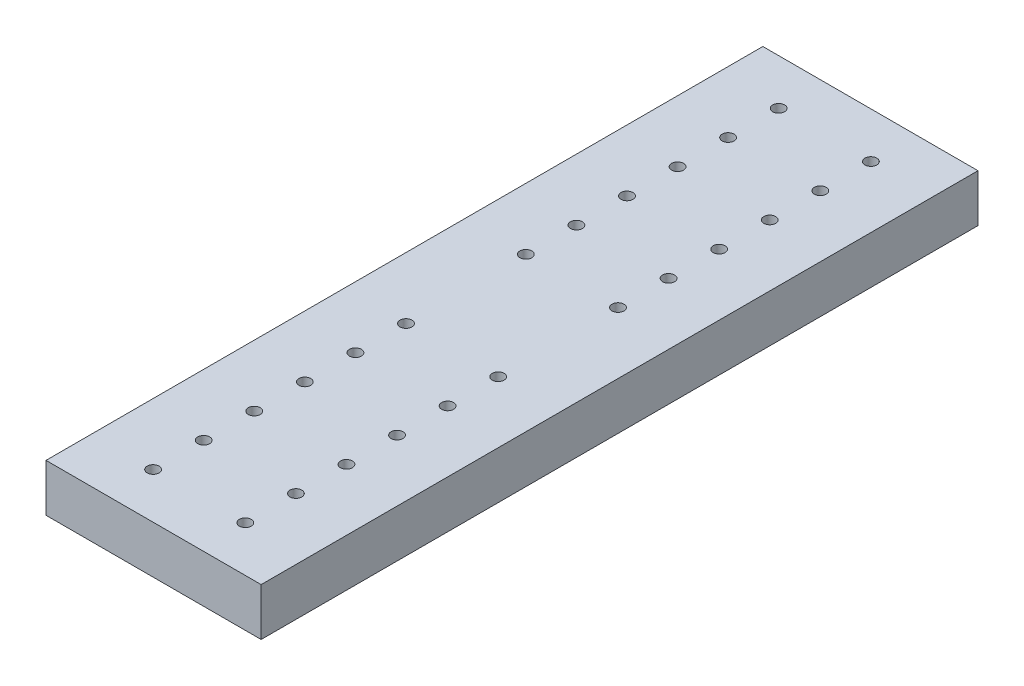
SolidWorks part; units mm, degrees
ref_plane "Front Plane" through (0, 0, 0) normal (1, 0, 0) x (0, 1, 0)
ref_plane "Top Plane" through (0, 0, 0) normal (0, 0, 1) x (0, 1, 0)
ref_plane "Right Plane" through (0, 0, 0) normal (0, 1, 0) x (-1, 0, 0)
sketch "118\"x6\" beam block support" plane through (0, 0, 0) normal (0, 1, 0) x (-1, 0, 0)
  line L1 (-339.725, 1763.525) -> (339.725, 1763.525)
  line L2 (-339.725, 1763.525) -> (-339.725, -1763.525)
  line L3 (-339.725, -1763.525) -> (339.725, -1763.525)
  line L4 (339.725, 1763.525) -> (339.725, -1763.525)
  line L5 (-339.725, 1763.525) -> (339.725, -1763.525) construction
  line L6 (-339.725, -1763.525) -> (339.725, 1763.525) construction
  point P0 (0, 0)
  line B0 (-215.9, 1639.7) -> (215.9, 1639.7) construction
  line B1 (-215.9, 1639.7) -> (-215.9, -1639.7) construction
  line B2 (-215.9, -1639.7) -> (215.9, -1639.7) construction
  line B3 (215.9, 1639.7) -> (215.9, -1639.7) construction
  line B4 (-215.9, 1639.7) -> (215.9, -1639.7) construction
  line B5 (-215.9, -1639.7) -> (215.9, 1639.7) construction
  circle B6 centre (246.0625, 1669.8625) radius 30.1625
  circle B7 centre (-246.0625, 1399.8625) radius 30.1625
  circle B8 centre (246.0625, 1399.8625) radius 30.1625
  circle B9 centre (246.0625, 1129.8625) radius 30.1625
  circle B10 centre (246.0625, 859.8625) radius 30.1625
  circle B11 centre (246.0625, -1129.8625) radius 30.1625
  circle B12 centre (-246.0625, -319.8625) radius 30.1625
  circle B13 centre (246.0625, 319.8625) radius 30.1625
  dimension "D1" = 3527.05
  dimension "D2" = 679.45
sketch_block_instance "bolt hole pat-2"
sketch_block "bolt hole pat" parameters "D1"=60.325, "D2"=60.325, "D3"=60.325, "D4"=60.325
sketch "Sketch1" plane through (0, 0, 0) normal (0, 1, 0) x (-1, 0, 0)
  line L0 (-339.725, 1763.525) -> (339.725, 1763.525) construction
  line L1 (-574.294, 1913.525) -> (574.294, 1913.525)
  line L2 (-574.294, 1913.525) -> (-574.294, -1913.525)
  line L3 (-574.294, -1913.525) -> (574.294, -1913.525)
  line L4 (574.294, 1913.525) -> (574.294, -1913.525)
  line L5 (-574.294, 1913.525) -> (574.294, -1913.525) construction
  line L6 (-574.294, -1913.525) -> (574.294, 1913.525) construction
  point P0 (0, 0)
  dimension "D1" = 1148.588
  dimension "D2" = 150
sketch "Sketch3"
sketch_block_instance "bolt hole pat-1"
extrude "Boss-Extrude1" add sketch "Sketch1" along normal blind 254
sketch "Sketch4" plane through (0, 0, 0) normal (0, 1, 0) x (-1, 0, 0)
  point P0 (0, 0)
  line B0 (-215.9, 1639.7) -> (215.9, 1639.7) construction
  line B1 (-215.9, 1639.7) -> (-215.9, -1639.7) construction
  line B2 (-215.9, -1639.7) -> (215.9, -1639.7) construction
  line B3 (215.9, 1639.7) -> (215.9, -1639.7) construction
  line B4 (-215.9, 1639.7) -> (215.9, -1639.7) construction
  line B5 (-215.9, -1639.7) -> (215.9, 1639.7) construction
  circle B6 centre (-246.0625, 1669.8625) radius 30.1625
  circle B7 centre (246.0625, 1669.8625) radius 30.1625
  circle B8 centre (-246.0625, 1399.8625) radius 30.1625
  circle B9 centre (246.0625, 1399.8625) radius 30.1625
  circle B10 centre (-246.0625, 1129.8625) radius 30.1625
  circle B11 centre (246.0625, 1129.8625) radius 30.1625
  circle B12 centre (-246.0625, 859.8625) radius 30.1625
  circle B13 centre (246.0625, 859.8625) radius 30.1625
  circle B14 centre (-246.0625, 589.8625) radius 30.1625
  circle B15 centre (246.0625, 589.8625) radius 30.1625
  circle B16 centre (-246.0625, -1669.8625) radius 30.1625
  circle B17 centre (246.0625, -1669.8625) radius 30.1625
  circle B18 centre (-246.0625, -1399.8625) radius 30.1625
  circle B19 centre (246.0625, -1399.8625) radius 30.1625
  circle B20 centre (-246.0625, -1129.8625) radius 30.1625
  circle B21 centre (246.0625, -1129.8625) radius 30.1625
  circle B22 centre (-246.0625, -859.8625) radius 30.1625
  circle B23 centre (246.0625, -859.8625) radius 30.1625
  circle B24 centre (-246.0625, -589.8625) radius 30.1625
  circle B25 centre (246.0625, -589.8625) radius 30.1625
  circle B26 centre (-246.0625, -319.8625) radius 30.1625
  circle B27 centre (246.0625, -319.8625) radius 30.1625
  circle B28 centre (-246.0625, 319.8625) radius 30.1625
  circle B29 centre (246.0625, 319.8625) radius 30.1625
sketch_block_instance "Block1-1"
sketch_block "Block1" parameters "D1"=60.325, "D2"=60.325, "D3"=60.325, "D4"=60.325
sketch "Sketch5" plane through (0, 0, 0) normal (0, 1, 0) x (-1, 0, 0)
  circle A0 centre (-246.0625, 1669.8625) radius 31.75
  circle A1 centre (246.0625, 1669.8625) radius 31.75
  circle A2 centre (-246.0625, -319.8625) radius 31.75
  circle A3 centre (246.0625, -319.8625) radius 31.75
  circle A4 centre (-246.0625, 1669.8625) radius 30.1625 construction
  circle A5 centre (246.0625, 1669.8625) radius 30.1625 construction
  circle A6 centre (-246.0625, -319.8625) radius 30.1625 construction
  circle A7 centre (246.0625, -319.8625) radius 30.1625 construction
  circle A8 centre (-246.0625, 1399.8625) radius 31.75
  circle A9 centre (246.0625, 1399.8625) radius 31.75
  circle A10 centre (-246.0625, -589.8625) radius 31.75
  circle A11 centre (246.0625, -589.8625) radius 31.75
  circle A12 centre (-246.0625, 1129.8625) radius 31.75
  circle A13 centre (246.0625, 1129.8625) radius 31.75
  circle A14 centre (-246.0625, -859.8625) radius 31.75
  circle A15 centre (246.0625, -859.8625) radius 31.75
  circle A16 centre (-246.0625, 859.8625) radius 31.75
  circle A17 centre (246.0625, 859.8625) radius 31.75
  circle A18 centre (-246.0625, -1129.8625) radius 31.75
  circle A19 centre (246.0625, -1129.8625) radius 31.75
  circle A20 centre (-246.0625, 589.8625) radius 31.75
  circle A21 centre (246.0625, 589.8625) radius 31.75
  circle A22 centre (-246.0625, -1399.8625) radius 31.75
  circle A23 centre (246.0625, -1399.8625) radius 31.75
  circle A24 centre (-246.0625, 319.8625) radius 31.75
  circle A25 centre (246.0625, 319.8625) radius 31.75
  circle A26 centre (-246.0625, -1669.8625) radius 31.75
  circle A27 centre (246.0625, -1669.8625) radius 31.75
  dimension "D1" = 63.5
  dimension "D2" = 63.5
  dimension "D3" = 63.5
  dimension "D4" = 63.5
  dimension "D5" = 6
extrude "Cut-Extrude1" cut sketch "Sketch5" along normal through all
